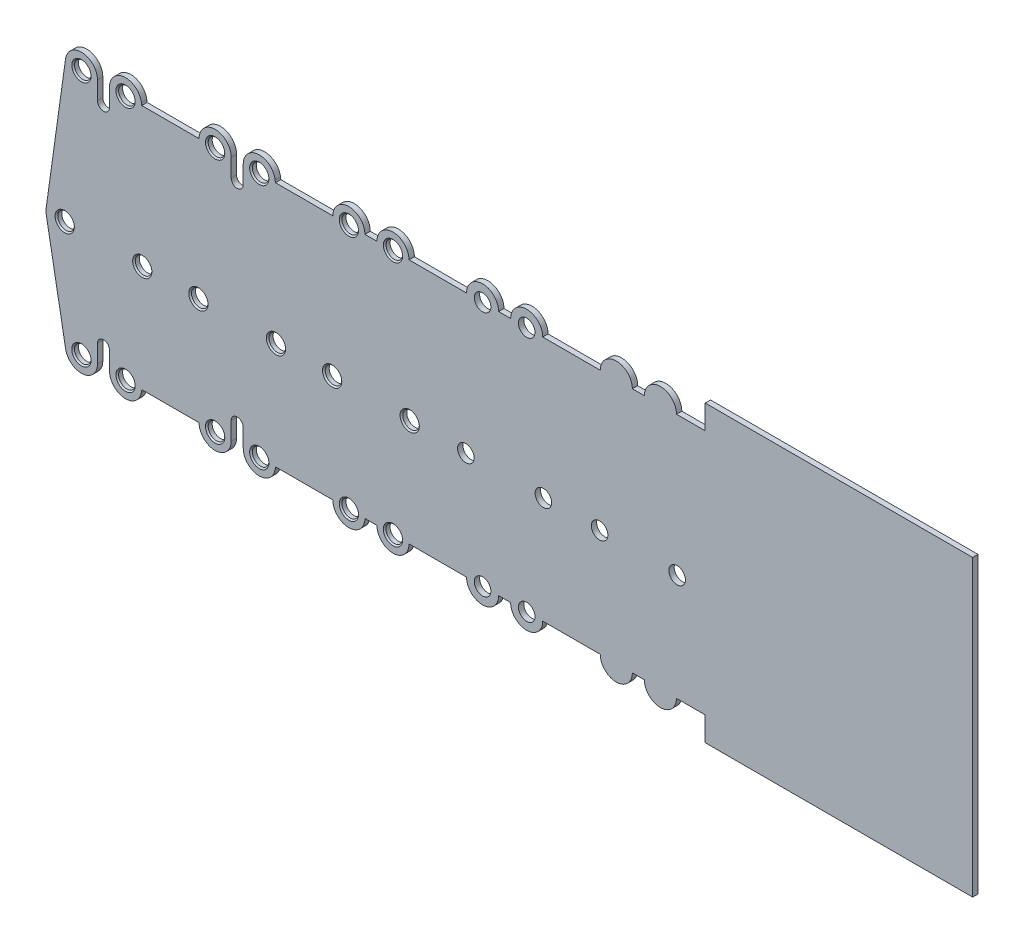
SolidWorks part; units mm, degrees
ref_plane "Face" through (0, 0, 0) normal (0, 0, 1) x (1, 0, 0)
ref_plane "Dessus" through (0, 0, 0) normal (0, 1, 0) x (1, 0, 0)
ref_plane "Droite" through (0, 0, 0) normal (1, 0, 0) x (0, 0, -1)
sketch "Esquisse1" plane through (0, 0, 0) normal (0, 0, 1) x (1, 0, 0)
  line L0 (0, 0) -> (0, 73.8116) construction
  line L1 (2.25, 45.25) -> (2.25, 52)
  line L2 (-2.25, 45.25) -> (-2.25, 52)
  line L3 (2.25, -33.25) -> (2.25, -40)
  line L4 (-2.25, -33.25) -> (-2.25, -40)
  line L5 (-14.1924, 52.8296) -> (-21.4328, 0.9679)
  line L6 (14.1924, 52.8296) -> (21.4328, 0.9679)
  line L7 (21.3873, -1.2511) -> (14.1534, -41.0724)
  line L8 (-21.3873, -1.2511) -> (-14.1534, -41.0724)
  circle A0 centre (-8.25, 52) radius 3.1
  circle A1 centre (8.25, 52) radius 3.1
  circle A2 centre (-14.5, 0) radius 3.1
  circle A3 centre (14.5, 0) radius 3.1
  circle A4 centre (-8.25, -40) radius 3.1
  circle A5 centre (8.25, -40) radius 3.1
  arc A6 (-2.25, 52) -> (-14.1924, 52.8296) centre (-8.25, 52) ccw
  arc A7 (14.1924, 52.8296) -> (2.25, 52) centre (8.25, 52) ccw
  arc A8 (21.3873, -1.2511) -> (21.4328, 0.9679) centre (14.5, 0) ccw
  arc A9 (-21.4328, 0.9679) -> (-21.3873, -1.2511) centre (-14.5, 0) ccw
  arc A10 (-14.1534, -41.0724) -> (-2.25, -40) centre (-8.25, -40) ccw
  arc A11 (2.25, -40) -> (14.1534, -41.0724) centre (8.25, -40) ccw
  arc A12 (2.25, 45.25) -> (-2.25, 45.25) centre (0, 45.25) cw
  arc A13 (2.25, -33.25) -> (-2.25, -33.25) centre (0, -33.25) ccw
  dimension "D1" = 6.2
  dimension "D8" = 12
  dimension "D9" = 14
  dimension "D10" = 2.25
  dimension "D2" = 14.5
  dimension "D3" = 29
  dimension "D4" = 52
  dimension "D5" = 8.25
  dimension "D6" = 16.5
  dimension "D7" = 40
  dimension "D11" = 6.75
  dimension "D12" = 6.75
extrude "Base-Extrusion" add sketch "Esquisse1" along normal blind 2
chamfer "Chanfrein1" distance 0.5 angle 45 6 edges at (-5.15, 52, 2) (11.35, 52, 2) (-11.4, 0, 2) (17.6, 0, 2) (-5.15, -40, 2) (11.35, -40, 2)
sketch "Esquisse3" plane through (0, 0, 2) normal (0, 0, 1) x (1, 0, 0)
  line L0 (21.4328, 0.9679) -> (14.1924, 52.8296) construction
  line L1 (21.4328, 0.9679) -> (14.3082, 52)
  line L2 (14.1534, -41.0724) -> (21.3873, -1.2511) construction
  line L3 (14.3482, -40) -> (21.3873, -1.2511)
  line L4 (25, 52) -> (25, -40)
  line L5 (25, -40) -> (14.3482, -40)
  line L6 (25, 52) -> (14.3082, 52)
  arc A0 (21.3873, -1.2511) -> (21.4328, 0.9679) centre (14.5, 0) ccw construction
  arc A1 (21.3873, -1.2511) -> (21.4328, 0.9679) centre (14.5, 0) ccw
  dimension "D1" = 25
  dimension "D2" = 52
  dimension "D3" = 40
extrude "Boss.-Extru.2" add sketch "Esquisse3" against normal blind 2
mirror "Symétrie1" about plane through (25, 52, 0) normal (1, 0, 0) of "Boss.-Extru.2"
pattern_linear "Répétition linéaire3" count 2 spacing 50 along (1, 0, 0) of "Base-Extrusion", "Chanfrein1", "Boss.-Extru.2"
sketch "Esquisse4" plane through (75, 0, 0) normal (1, 0, 0) x (0, 0, -1)
  line L4 (-2, 52) -> (-2, -40)
  line L5 (-2, -40) -> (0, -40)
  line L6 (0, -40) -> (0, 52)
  line L7 (0, 52) -> (-2, 52)
  line L8 (-2, 52) -> (-2, -40)
  line L9 (-2, -40) -> (0, -40)
  line L10 (0, -40) -> (0, 52)
  line L11 (0, 52) -> (-2, 52)
  dimension "D1" = 0
extrude "Boss.-Extru.3" add sketch "Esquisse4" along normal blind 250
sketch "Esquisse5" plane through (0, 0, 2) normal (0, 0, 1) x (1, 0, 0)
  line L0 (325, 52) -> (64.3082, 52) construction
  line L1 (64.3482, -40) -> (325, -40) construction
  line L2 (85.75, 52) -> (97.75, 52)
  line L3 (102.25, 52) -> (114.25, 52)
  line L4 (85.75, -40) -> (97.75, -40)
  line L5 (102.25, -40) -> (114.25, -40)
  arc A0 (97.75, 52) -> (85.75, 52) centre (91.75, 52) ccw
  arc A1 (102.25, 52) -> (114.25, 52) centre (108.25, 52) cw
  arc A2 (97.75, -40) -> (85.75, -40) centre (91.75, -40) cw
  arc A3 (114.25, -40) -> (102.25, -40) centre (108.25, -40) cw
  circle A5 centre (41.75, 52) radius 3.6 construction
  dimension "D1" = 6
  dimension "D2" = 50
  dimension "D3" = 16.5
extrude "Boss.-Extru.5" add sketch "Esquisse5" against normal blind 2
sketch "Esquisse6" plane through (0, 0, 2) normal (0, 0, 1) x (1, 0, 0)
  circle A0 centre (108.25, 52) radius 3.1
  circle A1 centre (91.75, 52) radius 3.1
  circle A2 centre (91.75, -40) radius 3.1
  circle A3 centre (108.25, -40) radius 3.1
  circle A4 centre (85.5, 0) radius 3.1
  circle A5 centre (114.5, 0) radius 3.1
  circle A6 centre (35.5, 0) radius 3.1 construction
  circle A7 centre (64.5, 0) radius 3.6 construction
  dimension "D1" = 6.2
  dimension "D3" = 50
  dimension "D2" = 50
extrude "Enlèv. mat.-Extru.1" cut sketch "Esquisse6" against normal through all
pattern_linear "Répétition linéaire4" count 3 spacing 50 along (1, 0, 0) of "Boss.-Extru.5"
chamfer "Chanfrein2" distance 0.5 angle 45 6 edges at (111.35, 52, 2) (94.85, 52, 2) (94.85, -40, 2) (111.35, -40, 2) (88.6, 0, 2) (117.6, 0, 2)
pattern_linear "Répétition linéaire5" count 2 spacing 50 along (1, 0, 0) of "Enlèv. mat.-Extru.1"
sketch "Esquisse7" plane through (0, 0, 2) normal (0, 0, 1) x (1, 0, 0)
  circle A0 centre (185.5, 0) radius 3.1
  circle A1 centre (214.5, 0) radius 3.1
  circle A2 centre (164.5, 0) radius 3.1 construction
  dimension "D1" = 29
  dimension "D2" = 50
extrude "Enlèv. mat.-Extru.2" cut sketch "Esquisse7" against normal through all
sketch "Esquisse8" plane through (0, 0, 2) normal (0, 0, 1) x (1, 0, 0)
  line L0 (325, 52) -> (325, -40) construction
  line L1 (225, 61) -> (325, 61)
  line L2 (225, 61) -> (225, -49)
  line L3 (225, -49) -> (325, -49)
  line L4 (325, 61) -> (325, -49)
  line L5 (202.25, 52) -> (197.75, 52) construction
  point P4 (200, 52)
  dimension "D3" = 25
  dimension "D1" = 61
  dimension "D2" = 49
extrude "Boss.-Extru.6" add sketch "Esquisse8" against normal blind 2
sketch "Esquisse10" plane through (0, 0, 2) normal (0, 0, 1) x (1, 0, 0)
  line L1 (97.75, 52) -> (102.25, 52)
  line L2 (97.75, 52) -> (97.75, 45.25)
  line L3 (97.75, -40) -> (102.25, -40)
  line L4 (102.25, 52) -> (102.25, 45.25)
  line L5 (97.75, -40) -> (97.75, -33.25)
  line L7 (102.25, -40) -> (102.25, -33.25)
  arc A0 (97.75, 45.25) -> (102.25, 45.25) centre (100, 45.25) ccw
  circle A1 centre (108.25, 52) radius 3.6 construction
  arc A2 (102.25, -33.25) -> (97.75, -33.25) centre (100, -33.25) ccw
  circle A3 centre (108.25, -40) radius 3.6 construction
  dimension "D1" = 2.25
  dimension "D2" = 6.75
  dimension "D3" = 6.75
  dimension "D4" = 2.25
extrude "Enlèv. mat.-Extru.3" cut sketch "Esquisse10" against normal through all
pattern_linear "Répétition linéaire6" count 3 spacing 50
